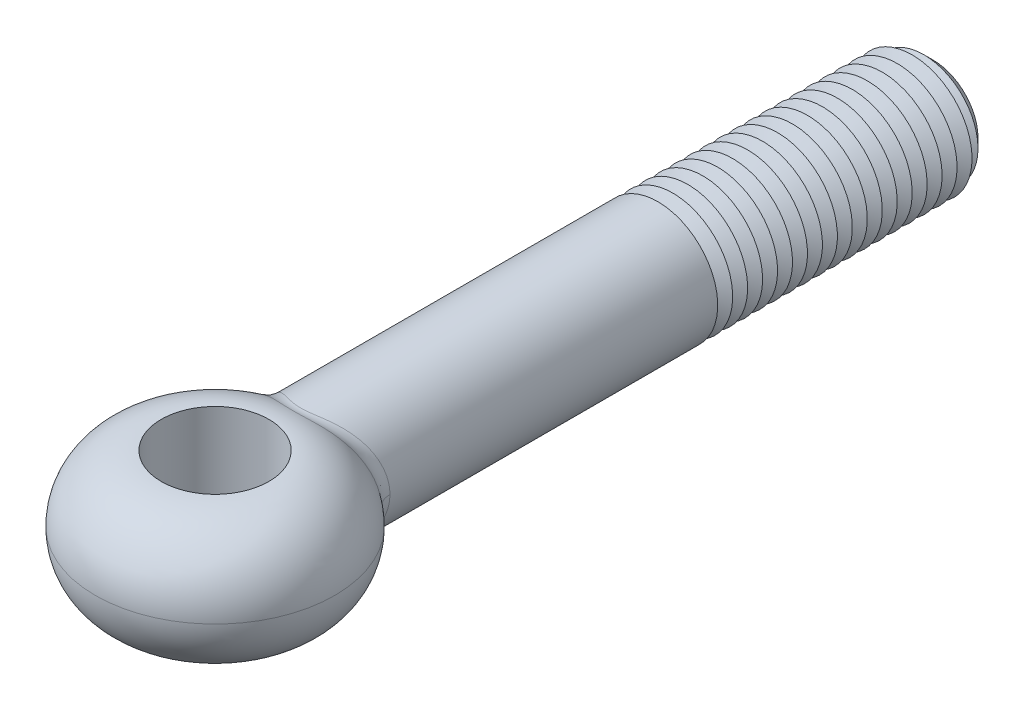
SolidWorks part; units mm, degrees
ref_plane "Front Plane" through (0, 0, 0) normal (0, 0, 1) x (1, 0, 0)
ref_plane "Top Plane" through (0, 0, 0) normal (0, 1, 0) x (1, 0, 0)
ref_plane "Right Plane" through (0, 0, 0) normal (1, 0, 0) x (0, 0, -1)
sketch "Sketch7" plane through (0, 0, 0) normal (0, 1, 0) x (1, 0, 0)
  circle A0 centre (0, 0) radius 20
  dimension "D1" = 40
extrude "Boss-Extrude3" add sketch "Sketch7" along normal mid plane 22
sketch "Sketch8" plane through (0, 0, 0) normal (0, 0, 1) x (1, 0, 0)
  circle A0 centre (0, 0) radius 10
  dimension "D1" = 20
extrude "Boss-Extrude4" add sketch "Sketch8" against normal blind 120
fillet "Fillet5" radius 11 2 edges at (0, -11, 20) (0, 11, 20)
fillet "Fillet6" radius 3.5 2 edges at (0.8553, -9.9634, -13.6349) (-0.8553, 9.9634, -13.6349)
chamfer "Chamfer1" distance 2.5 angle 45 1 edges at (10, 0, -120)
sketch "Sketch10" plane through (0, 0, 0) normal (0, 1, 0) x (1, 0, 0)
  line L0 (0, 28.1405) -> (0, -7.9233) construction
sketch "Sketch11" plane through (0, 0, 0) normal (0, 1, 0) x (1, 0, 0)
  line L0 (-10, 74) -> (-7.8349, 75.25)
  line L1 (-10, 117.5) -> (-10, 19.2354) construction
  line L2 (-7.8349, 75.25) -> (-10, 76.5)
  line L3 (-10, 76.5) -> (-10, 74)
  line L4 (7.5, 120) -> (-7.5, 120) construction
  dimension "D1" = 2.5
  dimension "D2" = 46
revolve "Cut-Revolve1" cut sketch "Sketch11" angle 360 about L0
pattern_linear "LPattern1" count 18 spacing 2.5 along (0, 0, -1) of "Cut-Revolve1"
sketch "Sketch12" plane through (0, 0, 0) normal (0, 1, 0) x (1, 0, 0)
  circle A0 centre (0, 0) radius 9
  dimension "D1" = 18
extrude "Cut-Extrude1" cut sketch "Sketch12" against normal mid plane 22
